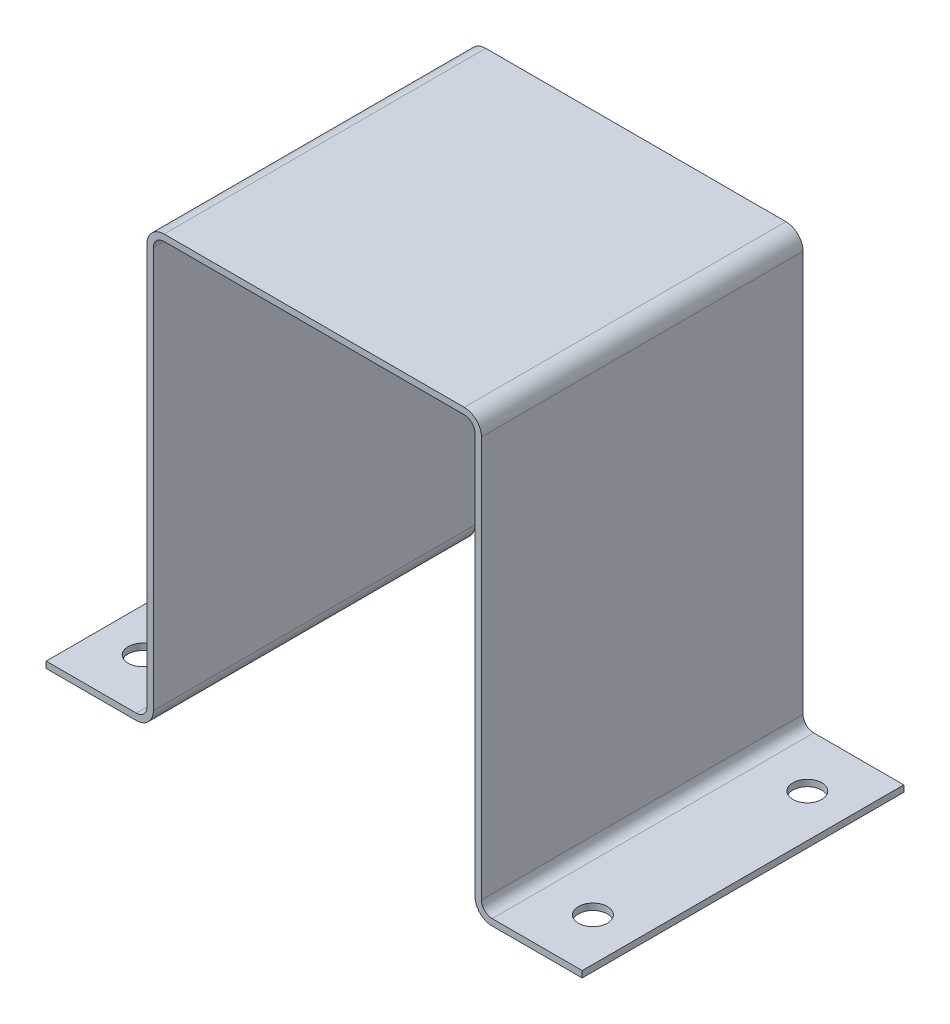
SolidWorks part; units mm, degrees
ref_plane "Front Plane" through (0, 0, 0) normal (0, 0, 1) x (1, 0, 0)
ref_plane "Top Plane" through (0, 0, 0) normal (0, 1, 0) x (1, 0, 0)
ref_plane "Right Plane" through (0, 0, 0) normal (1, 0, 0) x (0, 0, -1)
sketch "Sketch1" plane through (0, 0, 0) normal (0, 0, 1) x (1, 0, 0)
  line L0 (-75, 0) -> (75, 0)
  line L1 (75, 0) -> (75, -200)
  line L2 (-75, 0) -> (-75, -200)
  line L3 (75, -200) -> (125, -200)
  line L4 (-75, -200) -> (-125, -200)
  dimension "D1" = 150
  dimension "D2" = 200
  dimension "D3" = 50
extrude "Extrude-Thin1" add sketch "Sketch1" along normal mid plane 150 thin
hole_wizard "M12 Clearance Hole1" positions "Sketch3" profile "Sketch2" hole size "M12" standard "Ansi Metric"
sketch "Sketch3" plane through (0, -197, 0) normal (0, 1, 0) x (-1, 0, 0)
  line L1 (-125, 75) -> (-125, -75) construction
  line L2 (-125, -75) -> (-83, -75) construction
  point P0 (-105, -50)
  dimension "D1" = 25
  dimension "D2" = 20
sketch "Sketch2" plane through (105, -197, -50) normal (1, 0, 0) x (0, 0, 1)
  line L0 (0, 0) -> (0, 3)
  line L1 (0, 3) -> (6.75, 3)
  line L2 (6.75, 3) -> (6.75, 0)
  line L5 (6.75, 0) -> (0, 0)
  line L11 (0, -6.35) -> (0, 107.95) construction
  dimension "Thru Hole Dia." = 13.5
  dimension "Thru Hole Depth" = 3
mirror "Mirror1" about plane through (0, 0, 0) normal (0, 0, 1) of "M12 Clearance Hole1"
mirror "Mirror2" about plane through (0, 0, 0) normal (1, 0, 0) of "Mirror1", "M12 Clearance Hole1"
